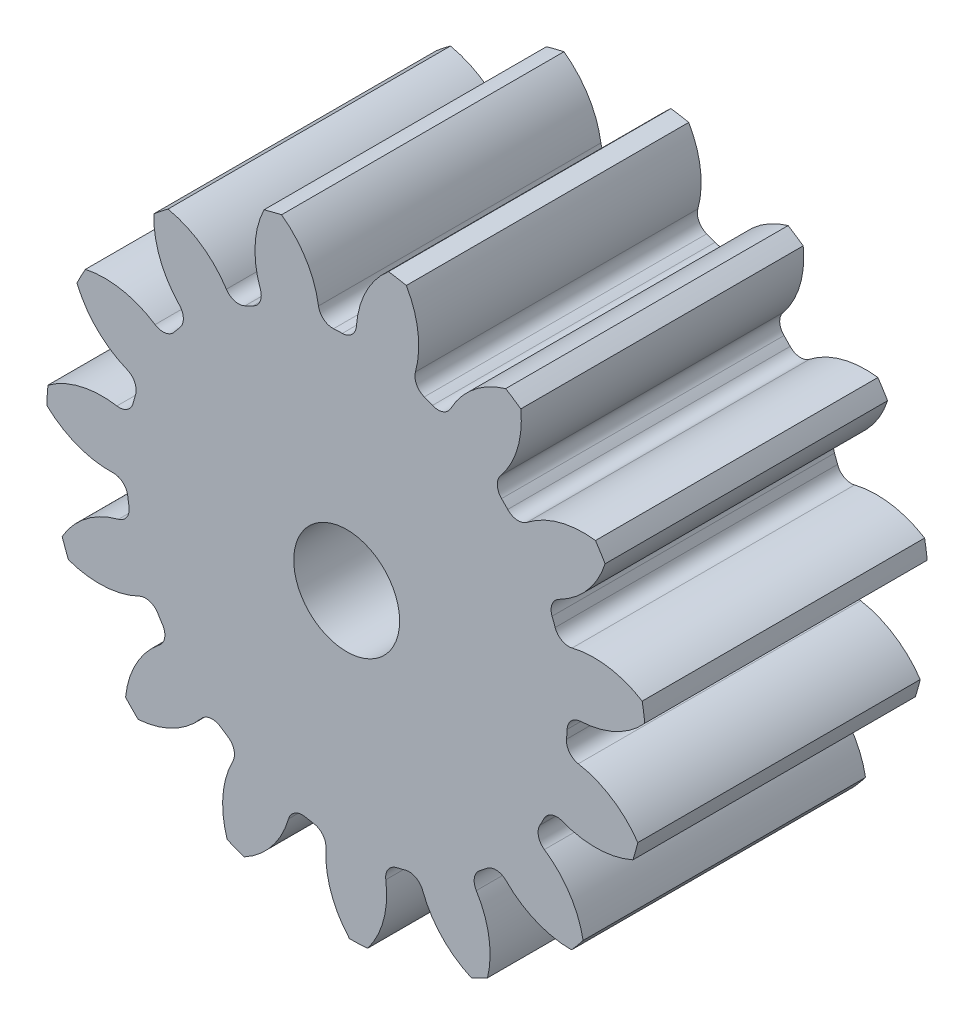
SolidWorks part; units mm, degrees
ref_plane "Front" through (0, 0, 0) normal (0, 0, 1) x (1, 0, 0)
ref_plane "Top" through (0, 0, 0) normal (0, 1, 0) x (1, 0, 0)
ref_plane "Right" through (0, 0, 0) normal (1, 0, 0) x (0, 0, -1)
sketch "Sketch3" plane through (0, 0, 0) normal (0, 0, 1) x (1, 0, 0)
  circle A0 centre (0, 0) radius 107.95
  dimension "od" = 215.9
extrude "gearBody" add sketch "Sketch3" along normal blind 101.6
sketch "Sketch2" plane through (0, 0, 0) normal (0, 0, 1) x (1, 0, 0)
  line L0 (0, 0) -> (82.6925, 34.2524) construction
  line L1 (105.331, -27.0213) -> (0, 0) construction
  line L2 (0, 0) -> (36.3143, 0) construction
  line L3 (95.1756, 3.7628) -> (93.8787, -16.1044) construction
  line L5 (94.5272, -6.1708) -> (0, 0) construction
  line L7 (0, 0) -> (89.5057, 0) construction
  arc A0 (89.4831, 2.0137) -> (88.4618, -13.6301) centre (0, 0) ccw construction
  arc A1 (107.2484, 12.2876) -> (104.7407, -26.1264) centre (0, 0) ccw construction
  arc A2 (95.1756, 3.7628) -> (93.8787, -16.1044) centre (0, 0) ccw construction
  arc A3 (79.0874, -6.7512) -> (79.2939, -3.5881) centre (0, 0) ccw
  arc A4 (105.331, -27.0213) -> (83.3289, -12.2792) centre (77.5376, -44.7123) ccw
  arc A5 (105.331, -27.0213) -> (107.95, 13.0981) centre (0, 0) ccw
  arc A6 (107.95, 13.0981) -> (84.2181, 1.3416) centre (82.6925, 34.2524) cw
  arc A7 (79.2939, -3.5881) -> (84.2181, 1.3416) centre (84.4575, -3.8217) cw
  arc A8 (83.3289, -12.2792) -> (79.0874, -6.7512) centre (84.2375, -7.1908) cw
  point P6 (107.95, 13.0981)
  point P22 (105.331, -27.0213)
  dimension "baseDia" = 179.0114
  dimension "od" = 215.9
  dimension "pd" = 190.5
  dimension "rd" = 158.75
  dimension "rFillet" = 5.1689
  dimension "pointX" = 107.95
  dimension "pointY" = 13.0981
  dimension "CTT" = 19.8672
  dimension "flankCenterAngle" = 22.5
extrude "toothCut" cut sketch "Sketch2" along normal through all
pattern_circular "CirPattern1" count 15 over 360 about axis through (0, 0, 0) along (0, 0, 1) of "toothCut"
sketch "hub1Dia" plane through (0, 0, 0) normal (0, 0, -1) x (-1, 0, 0)
  circle A0 centre (0, 0) radius 12.7
  dimension "hub1Dia" = 25.4
sketch "hub2Dia" plane through (0, 0, 101.6) normal (0, 0, 1) x (1, 0, 0)
  circle A0 centre (0, 0) radius 12.7
  dimension "hub2dia" = 25.4
sketch "boreDia" plane through (0, 0, 0) normal (0, 0, 1) x (1, 0, 0)
  circle A0 centre (0, 0) radius 19.05
  dimension "boreDia" = 38.1
extrude "bore" cut sketch "boreDia" against normal mid plane 25400
